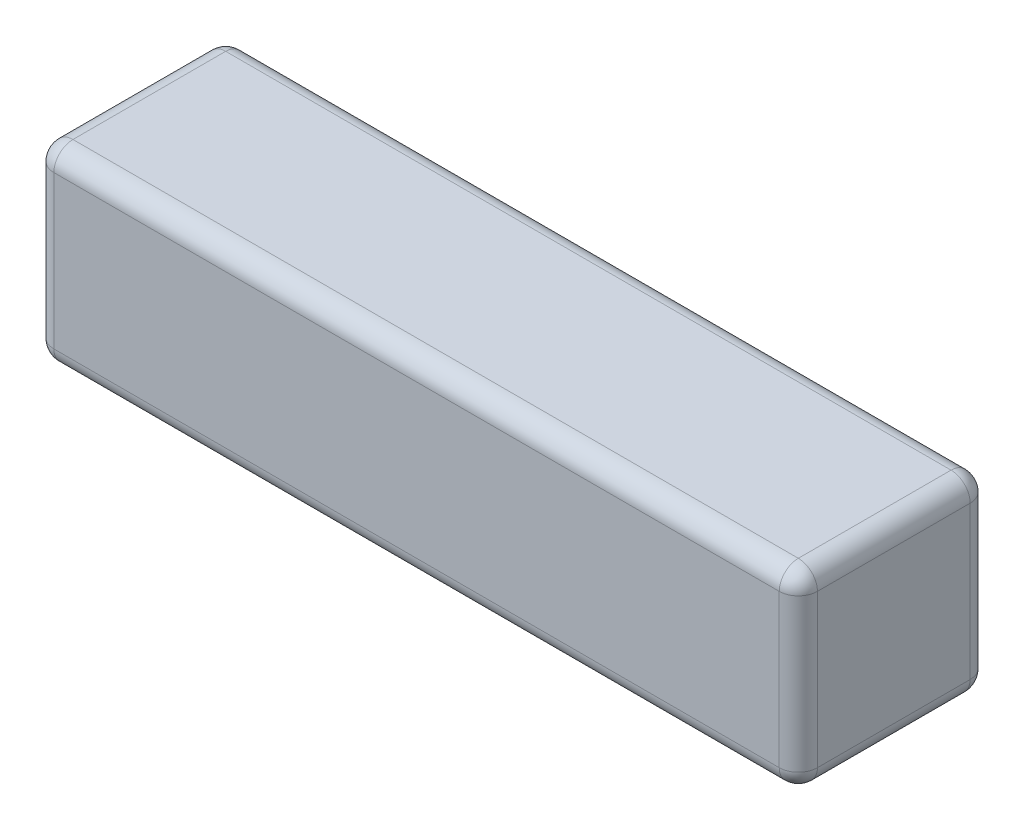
SolidWorks part; units mm, degrees
ref_plane "Front Plane" through (0, 0, 0) normal (0, 0, 1) x (1, 0, 0)
ref_plane "Top Plane" through (0, 0, 0) normal (0, 1, 0) x (1, 0, 0)
ref_plane "Right Plane" through (0, 0, 0) normal (1, 0, 0) x (0, 0, -1)
sketch "Sketch1" plane through (0, 0, 0) normal (0, 0, 1) x (1, 0, 0)
  line L0 (-26.4, 14.7403) -> (73.6, 14.7403)
  line L1 (-326.4, 114.7403) -> (73.6, 114.7403)
  line L2 (-326.4, 114.7403) -> (-326.4, 14.7403)
  line L3 (-326.4, 14.7403) -> (-26.4, 14.7403)
  line L4 (73.6, 114.7403) -> (73.6, 14.7403)
  dimension "D1" = 100
  dimension "D2" = 400
extrude "Boss-Extrude1" add sketch "Sketch1" along normal blind 100
fillet "Fillet3" radius 10 12 edges at (73.6, 14.7403, 50) (-126.4, 14.7403, 0) (73.6, 64.7403, 0) (-326.4, 14.7403, 50) (-326.4, 64.7403, 0) (73.6, 64.7403, 100) (-126.4, 14.7403, 100) (-326.4, 64.7403, 100) (73.6, 114.7403, 50) (-126.4, 114.7403, 100) (-326.4, 114.7403, 50) (-126.4, 114.7403, 0)
